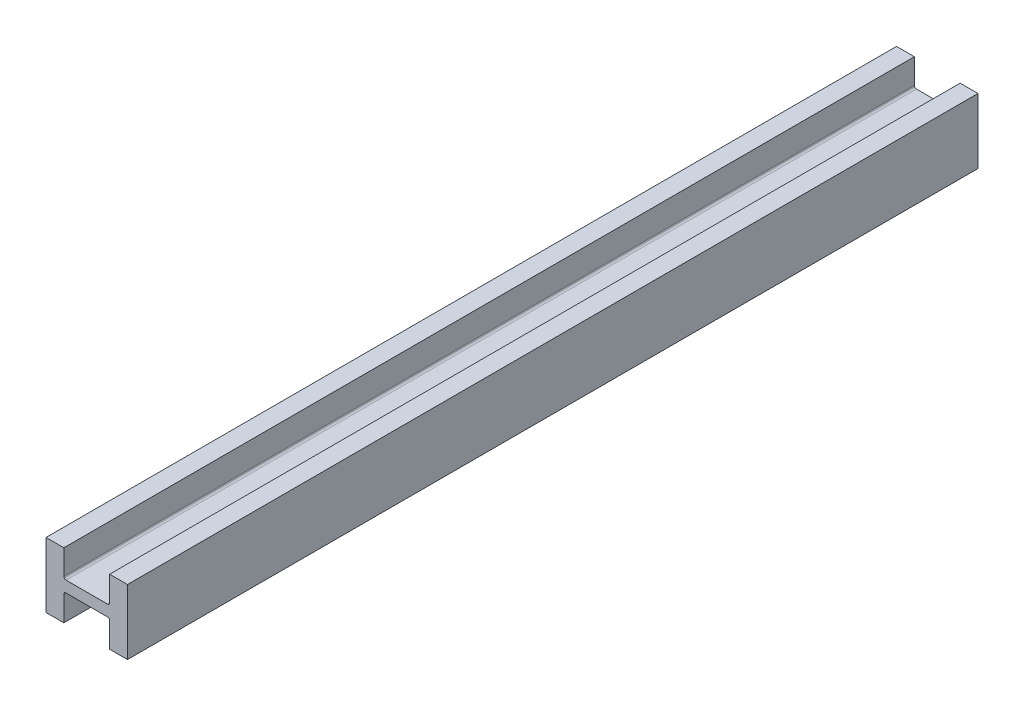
SolidWorks part; units mm, degrees
ref_plane "Front Plane" through (0, 0, 0) normal (1, 0, 0) x (0, 1, 0)
ref_plane "Top Plane" through (0, 0, 0) normal (0, 0, 1) x (0, 1, 0)
ref_plane "Right Plane" through (0, 0, 0) normal (0, 1, 0) x (-1, 0, 0)
sketch "sk W14x730" plane through (0, 0, 0) normal (0, 0, 1) x (0, 1, 0)
  point P0 (-227.203, -284.734)
  point P1 (0, -284.734)
  point P2 (-38.989, 0)
  line B0 (-227.203, -284.734) -> (-227.203, -160.02)
  line B1 (-227.203, -160.02) -> (-54.229, -160.02)
  line B2 (-38.989, -144.78) -> (-38.989, 144.78)
  line B3 (-54.229, 160.02) -> (-227.203, 160.02)
  line B4 (-227.203, 160.02) -> (-227.203, 284.734)
  line B5 (-227.203, 284.734) -> (227.203, 284.734)
  line B6 (227.203, 284.734) -> (227.203, 160.02)
  line B7 (227.203, 160.02) -> (54.229, 160.02)
  line B8 (38.989, 144.78) -> (38.989, -144.78)
  line B9 (54.229, -160.02) -> (227.203, -160.02)
  line B10 (227.203, -160.02) -> (227.203, -284.734)
  line B11 (227.203, -284.734) -> (-227.203, -284.734)
  arc B12 (-54.229, -160.02) -> (-38.989, -144.78) centre (-54.229, -144.78) ccw
  arc B13 (-38.989, 144.78) -> (-54.229, 160.02) centre (-54.229, 144.78) ccw
  arc B14 (54.229, 160.02) -> (38.989, 144.78) centre (54.229, 144.78) ccw
  arc B15 (38.989, -144.78) -> (54.229, -160.02) centre (54.229, -144.78) ccw
sketch_block_instance "W14x730-1"
sketch_block "W14x730" parameters "D4"=15.24, "D1"=454.406, "D2"=569.468, "D3"=77.978, "D5"=124.714, "D6"=6.35
extrude "Beam Body" add sketch "sk W14x730" along normal mid plane 5943.6
